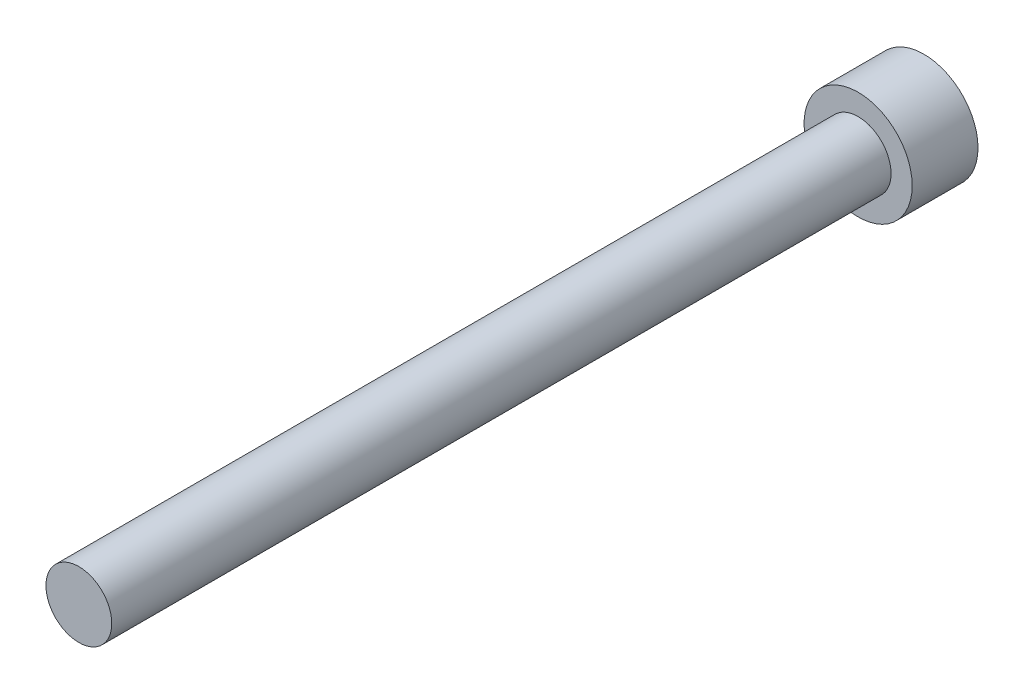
SolidWorks part; units mm, degrees
ref_plane "Front Plane" through (0, 0, 0) normal (0, 0, 1) x (1, 0, 0)
ref_plane "Top Plane" through (0, 0, 0) normal (0, 1, 0) x (1, 0, 0)
ref_plane "Right Plane" through (0, 0, 0) normal (1, 0, 0) x (0, 0, -1)
sketch "Sketch6" plane through (0, 0, 0) normal (1, 0, 0) x (0, 0, -1)
  line L0 (-57.15, 0) -> (22.525, 0) construction
  line L1 (4.3586, 0) -> (-4.3586, 0) construction
  line L2 (-57.15, 0) -> (-57.15, -2.413)
  line L3 (-57.15, -2.413) -> (0, -2.413)
  line L4 (0, 4.3586) -> (0, -4.3586) construction
  line L5 (0, -2.413) -> (0, -3.9624)
  line L6 (0, -3.9624) -> (4.826, -3.9624)
  line L7 (4.826, -3.9624) -> (4.826, 0)
  line L8 (4.826, 0) -> (-57.15, 0)
  dimension "L" = 57.15
  dimension "H" = 4.826
  dimension "A" = 7.9248
  dimension "D" = 4.826
revolve "Revolve1" add sketch "Sketch6" angle 360 about L0
sketch "Sketch7" plane through (0, 0, -4.826) normal (0, 0, -1) x (-1, 0, 0)
  line L2 (-1.9812, 1.1438) -> (-1.9812, -1.1438)
  line L4 (-1.9812, -1.1438) -> (0, -2.2877)
  line L5 (0, -2.2877) -> (1.9812, -1.1438)
  line L6 (1.9812, -1.1438) -> (1.9812, 1.1438)
  line L7 (1.9812, 1.1438) -> (0, 2.2877)
  line L8 (0, 2.2877) -> (-1.9812, 1.1438)
  circle A0 centre (0, 0) radius 1.9812 construction
  dimension "J" = 3.9624
extrude "HEX" cut sketch "Sketch7" against normal blind 3.048
